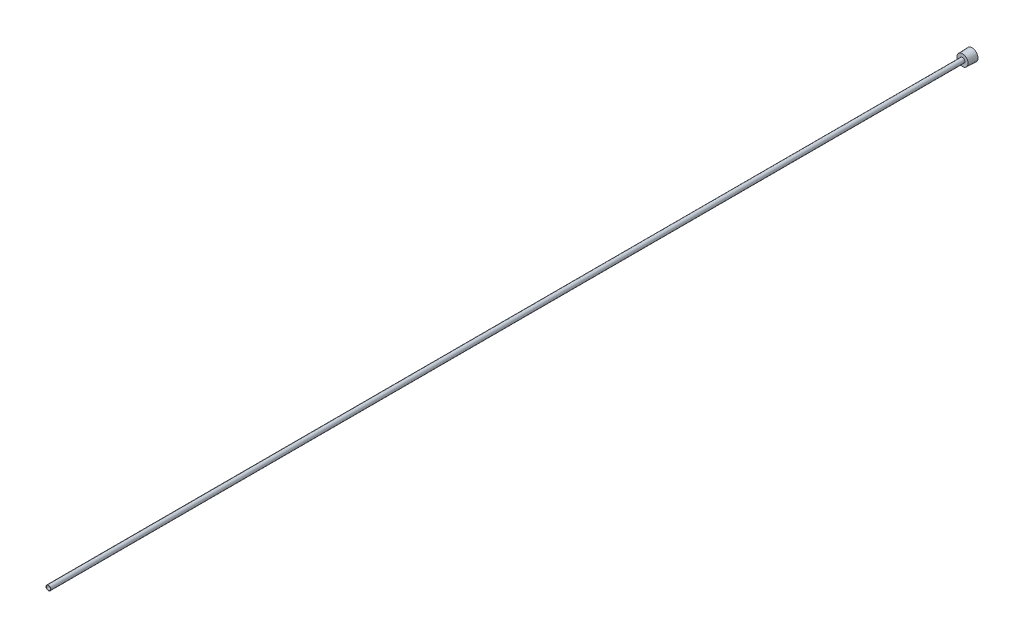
SolidWorks part; units mm, degrees
ref_plane "Front Plane" through (0, 0, 0) normal (0, 0, 1) x (1, 0, 0)
ref_plane "Top Plane" through (0, 0, 0) normal (0, 1, 0) x (1, 0, 0)
ref_plane "Right Plane" through (0, 0, 0) normal (1, 0, 0) x (0, 0, -1)
sketch "Sketch1" plane through (0, 0, 0) normal (1, 0, 0) x (0, 0, -1)
  line L0 (-609.6, 0) -> (0, 0)
  line L5 (0, 3.8989) -> (-6.35, 3.6674)
  line L6 (0, 0) -> (0, 3.8989)
  line L7 (-6.35, 3.6674) -> (-6.35, 1.5875)
  line L8 (-6.35, 1.5875) -> (-609.6, 1.5875)
  line L9 (-609.6, 1.5875) -> (-609.6, 0)
  line L10 (0, 0) -> (49989.3417, 0) construction
  dimension "D1" = 2.088
  dimension "D2" = 6.35
  dimension "D3" = 609.6
  dimension "D4" = 3.175
  dimension "D5" = 7.7978
revolve "Revolve1" add sketch "Sketch1" angle 360 about L10
sketch "Sketch2" plane through (0, 0, 609.6) normal (0, 0, 1) x (1, 0, 0)
  circle A0 centre (0, 0) radius 1.3843
  dimension "D1" = 2.7686
extrude "Cut-Extrude1" cut sketch "Sketch2" against normal through all
sketch "Sketch3" plane through (0, 0, 0) normal (0, 0, -1) x (-1, 0, 0)
  line L0 (4.2888, 0) -> (-4.2888, 0) construction
  line L1 (1.3748, 2.3813) -> (-1.3748, 2.3813)
  line L2 (-1.3748, 2.3813) -> (-2.7496, 0)
  line L3 (-2.7496, 0) -> (-1.3748, -2.3813)
  line L4 (-1.3748, -2.3813) -> (1.3748, -2.3813)
  line L5 (1.3748, -2.3813) -> (2.7496, 0)
  line L6 (2.7496, 0) -> (1.3748, 2.3813)
  circle A0 centre (0, 0) radius 2.3813 construction
  dimension "D1" = 4.7625
extrude "Cut-Extrude2" cut sketch "Sketch3" against normal blind 2.54
